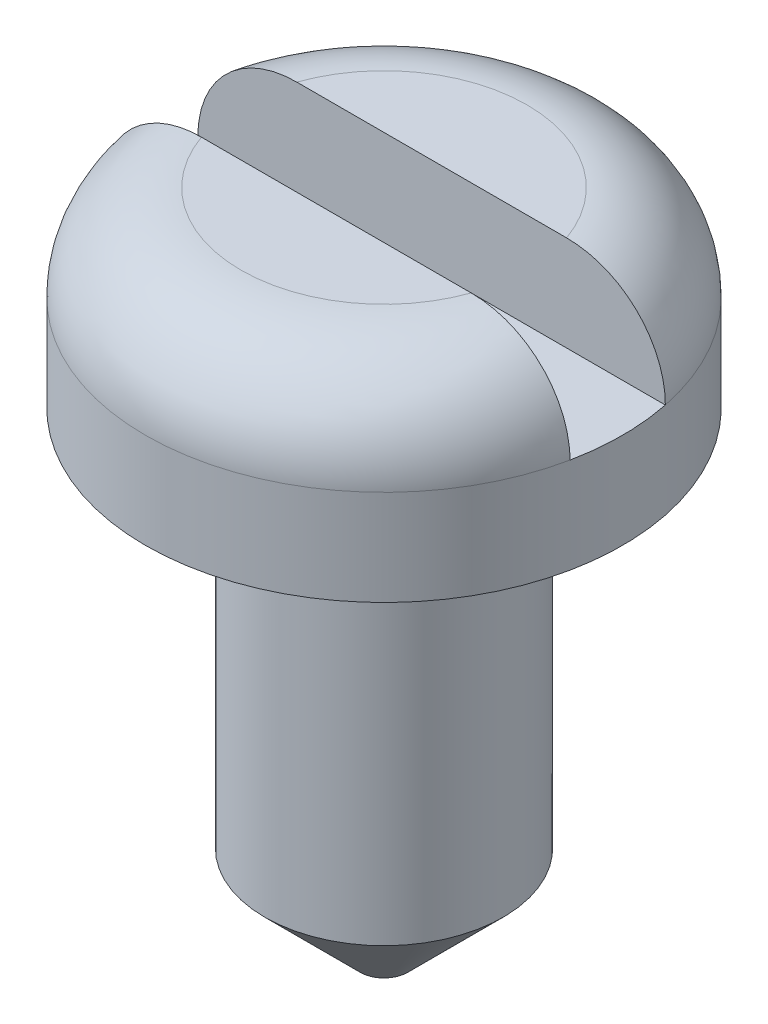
SolidWorks part; units mm, degrees
ref_plane "Front Plane" through (0, 0, 0) normal (0, 0, 1) x (1, 0, 0)
ref_plane "Top Plane" through (0, 0, 0) normal (0, 1, 0) x (1, 0, 0)
ref_plane "Right Plane" through (0, 0, 0) normal (1, 0, 0) x (0, 0, -1)
sketch "Sketch2" plane through (0, 0, 0) normal (0, 1, 0) x (1, 0, 0)
  circle A0 centre (0, 0) radius 1.5875
  dimension "D1" = 3.175
extrude "Boss-Extrude1" add sketch "Sketch2" along normal blind 6.35
sketch "Sketch3" plane through (0, 6.35, 0) normal (0, 1, 0) x (1, 0, 0)
  circle A0 centre (0, 0) radius 3.175
  dimension "D1" = 6.35
extrude "Boss-Extrude2" add sketch "Sketch3" along normal blind 2.54
sketch "Sketch4" plane through (0, 0, 0) normal (1, 0, 0) x (0, 0, -1)
  line L0 (3.175, 8.89) -> (-3.175, 8.89) construction
  line L1 (-0.635, 10.16) -> (0.635, 10.16)
  line L2 (-0.635, 10.16) -> (-0.635, 7.62)
  line L3 (-0.635, 7.62) -> (0.635, 7.62)
  line L4 (0.635, 10.16) -> (0.635, 7.62)
  line L5 (-0.635, 10.16) -> (0.635, 7.62) construction
  line L6 (-0.635, 7.62) -> (0.635, 10.16) construction
  point P0 (0, 8.89)
  dimension "D1" = 1.27
  dimension "D2" = 2.54
extrude "Cut-Extrude1" cut sketch "Sketch4" against normal blind 4.318 and the other way blind 6.096
fillet "Fillet2" radius 1.27 2 edges at (0, 8.89, -3.175) (0, 8.89, 3.175)
chamfer "Chamfer1" distance 1.27 angle 45 1 edges at (0, 0, 1.5875)
